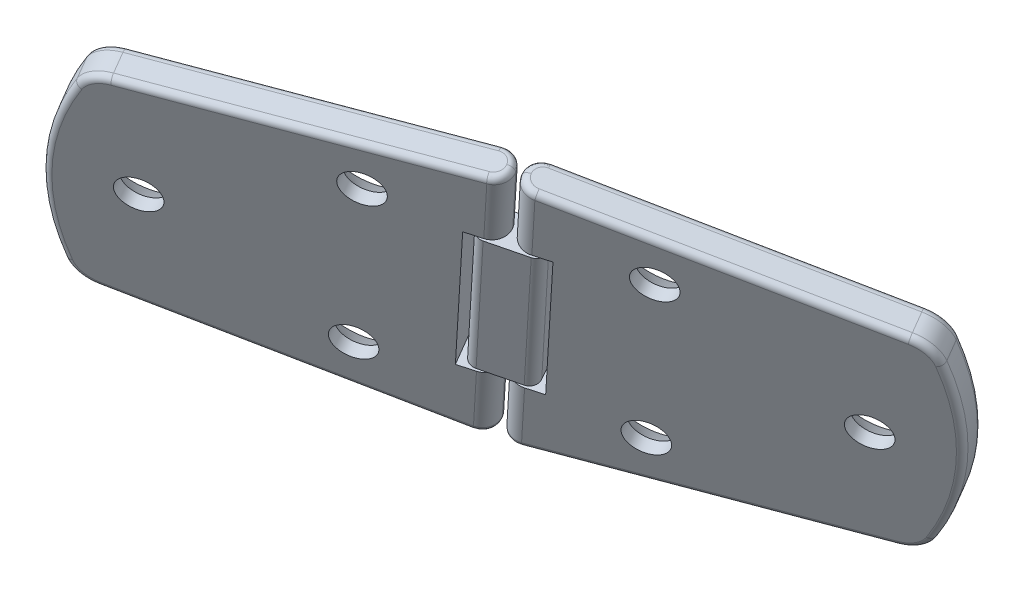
SolidWorks part; units mm, degrees
ref_plane "前视基准面" through (0, 0, 0) normal (0, 0, 1) x (1, 0, 0)
ref_plane "上视基准面" through (0, 0, 0) normal (0, 1, 0) x (1, 0, 0)
ref_plane "右视基准面" through (0, 0, 0) normal (1, 0, 0) x (0, 0, -1)
other "Configuration Table"
imported_body "Part2-Mirror17-1-solid1"
imported_body "Part2-Boss-Extrude3-1-solid1"
imported_body "Part2-Mirror171-1-solid1"
imported_body "Part2-Mirror171-1-solid2"
imported_body "Part2-Mirror171-1-solid3"
imported_body "Part2-Mirror171-1-solid4"
imported_body "Part2-Mirror17-3-solid1"
scale "缩放比例1" bodies to scale 109 106 110 112 111 108 107 scale about origin uniform scaling yes scale factor 0.3
